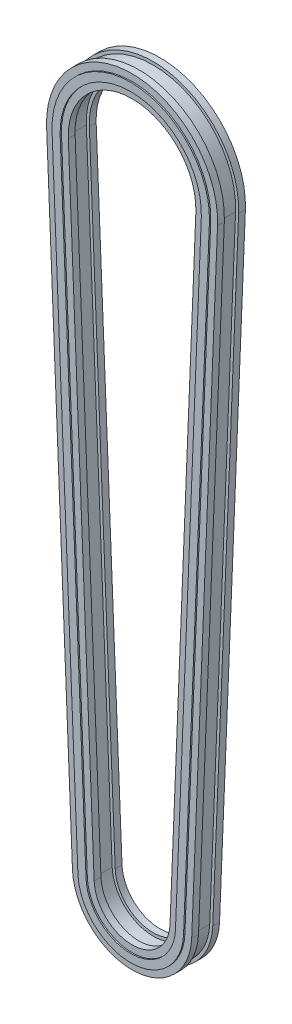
SolidWorks part; units mm, degrees
ref_plane "Plan de face" through (0, 0, 0) normal (0, 0, 1) x (1, 0, 0)
ref_plane "Plan de dessus" through (0, 0, 0) normal (0, 1, 0) x (1, 0, 0)
ref_plane "Plan de droite" through (0, 0, 0) normal (1, 0, 0) x (0, 0, -1)
sketch "Esquisse1" plane through (0, 0, 0) normal (0, 0, 1) x (1, 0, 0)
  line L0 (26.5077, -1.0879) -> (40.5609, 341.3354)
  line L3 (-40.5609, 341.3354) -> (-26.5077, -1.0879)
  arc A0 (40.5609, 341.3354) -> (-40.5609, 341.3354) centre (0, 343) ccw
  arc A2 (-26.5077, -1.0879) -> (26.5077, -1.0879) centre (0, 0) ccw
  dimension "D1" = 343
  dimension "D2" = 40.595
  dimension "D3" = 26.53
ref_plane "Plan1" through (40.5609, 341.3354, 0) normal (0.041, 0.9992, 0) x (-0.9992, 0.041, 0)
sketch "Esquisse2" plane through (-142.6285, 348.8535, 0) normal (0.041, 0.9992, 0) x (0, 0, 1)
  line L0 (3.875, 179.0936) -> (-3.875, 179.0936)
  line L6 (-3.875, 179.0936) -> (-3.875, 177.4436)
  line L7 (-3.875, 177.4436) -> (-7.57, 177.4436)
  line L8 (-7.57, 177.4436) -> (-7.57, 181.1436)
  line L9 (-7.57, 181.1436) -> (-8.3, 181.1436)
  line L10 (-8.3, 181.1436) -> (-8.3, 185.5436)
  line L11 (-8.3, 185.5436) -> (-7.57, 185.5436)
  line L12 (-7.57, 185.5436) -> (-7.57, 189.2436)
  line L13 (-7.57, 189.2436) -> (-3.875, 189.2436)
  line L14 (-3.875, 189.2436) -> (-3.875, 187.5936)
  line L15 (-3.875, 187.5936) -> (3.875, 187.5936)
  line L16 (3.875, 187.5936) -> (3.875, 189.2436)
  line L17 (3.875, 189.2436) -> (7.57, 189.2436)
  line L18 (7.57, 189.2436) -> (7.57, 185.5436)
  line L19 (7.57, 185.5436) -> (8.3, 185.5436)
  line L20 (8.3, 185.5436) -> (8.3, 181.1436)
  line L21 (8.3, 181.1436) -> (7.57, 181.1436)
  line L22 (7.57, 181.1436) -> (7.57, 177.4436)
  line L23 (7.57, 177.4436) -> (3.875, 177.4436)
  line L24 (3.875, 177.4436) -> (3.875, 179.0936)
  line L25 (-8.3, 183.3436) -> (8.3, 183.3436) construction
  line L26 (0, 187.5936) -> (0, 179.0936) construction
  dimension "D5" = 16.6
  dimension "D6" = 0.73
  dimension "D7" = 0.73
  dimension "D8" = 7.75
  dimension "D9" = 11.8
  dimension "D10" = 8.5
  dimension "D11" = 4.4
  dimension "D12" = 3.7
  dimension "D13" = 1.65
  dimension "D14" = 7.57
sweep "Balayage1" add profiles "Esquisse2" path "Esquisse1"
